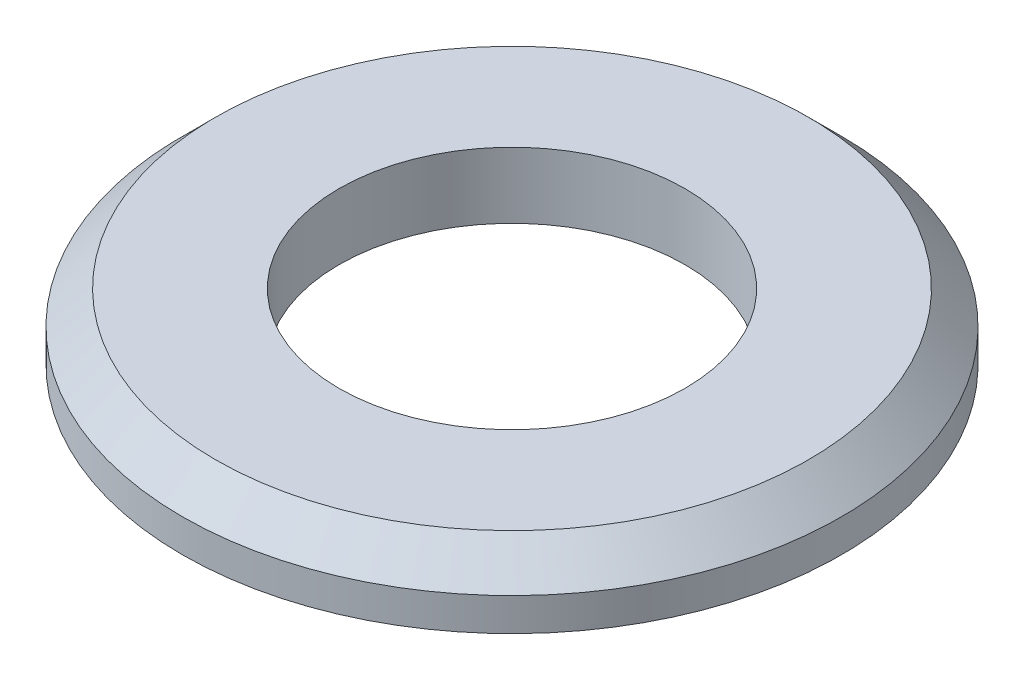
SolidWorks part; units mm, degrees
ref_plane "Front" through (0, 0, 0) normal (0, 0, 1) x (1, 0, 0)
ref_plane "Top" through (0, 0, 0) normal (0, 1, 0) x (1, 0, 0)
ref_plane "Right" through (0, 0, 0) normal (1, 0, 0) x (0, 0, -1)
sketch "Sketch1" plane through (0, 0, 0) normal (0, 1, 0) x (1, 0, 0)
  circle A0 centre (0, 0) radius 5.25
  circle A1 centre (0, 0) radius 10
extrude "Extrude1" add sketch "Sketch1" along normal blind 2
chamfer "Chamfer1" distance 1 1 edges at (0, 2, 10)
